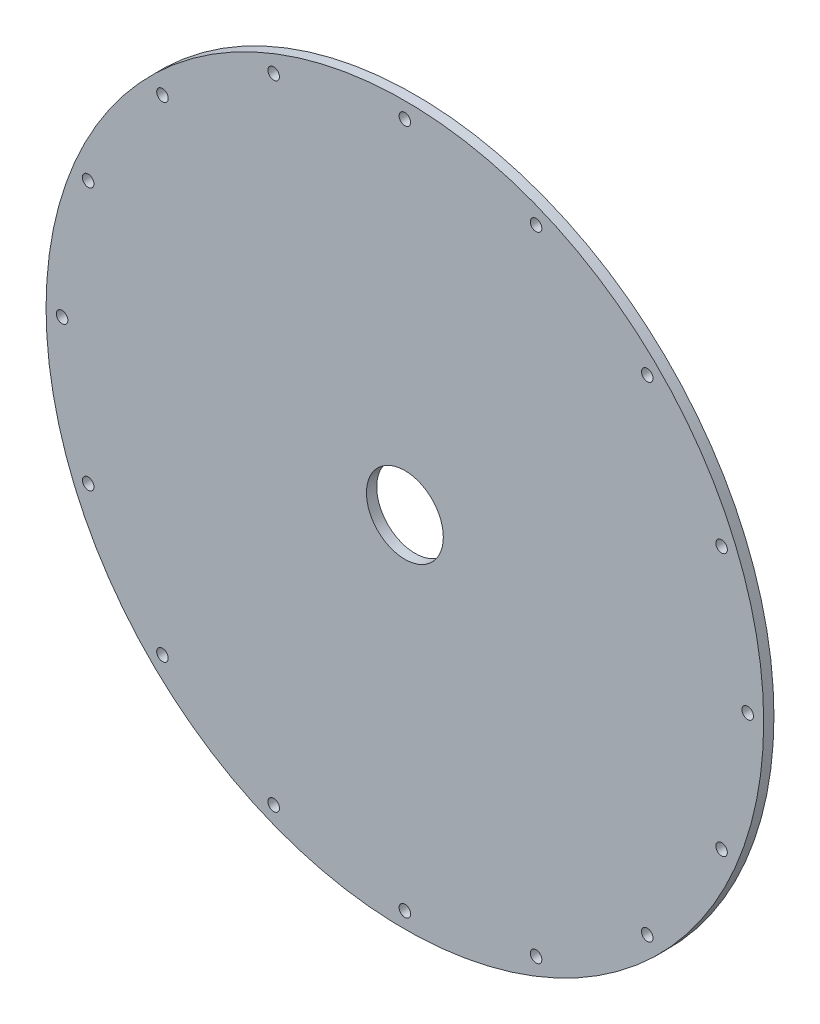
SolidWorks part; units mm, degrees
ref_plane "前视基准面" through (0, 0, 0) normal (0, 0, 1) x (1, 0, 0)
ref_plane "上视基准面" through (0, 0, 0) normal (0, 1, 0) x (1, 0, 0)
ref_plane "右视基准面" through (0, 0, 0) normal (1, 0, 0) x (0, 0, -1)
sketch "草图1" plane through (0, 0, 0) normal (0, 0, 1) x (1, 0, 0)
  circle A0 centre (0, 0) radius 280
  circle A1 centre (0, 0) radius 30
  dimension "D1" = 560
  dimension "D2" = 60
extrude "拉伸1" add sketch "草图1" along normal blind 8
hole_wizard "孔1" positions "草图3" profile "草图2" legacy
sketch "草图3" plane through (0, 0, 8) normal (0, 0, 1) x (1, 0, 0)
  point P0 (0, 267.5)
  dimension "D1" = 267.5
sketch "草图2" plane through (0, 267.5, 8) normal (1, 0, 0) x (0, -1, 0)
  line L0 (0, 0) -> (0, 8)
  line L1 (0, 8) -> (4.5, 8)
  line L2 (4.5, 8) -> (4.5, 0)
  line L3 (4.5, 0) -> (0, 0)
  line L4 (0, 110) -> (0, -10) construction
  dimension "直径" = 9
  dimension "深度" = 8
pattern_circular "阵列(圆周)1" count 16 over 360 about axis through (0, 0, 0) along (0, 0, 1) of "孔1"
